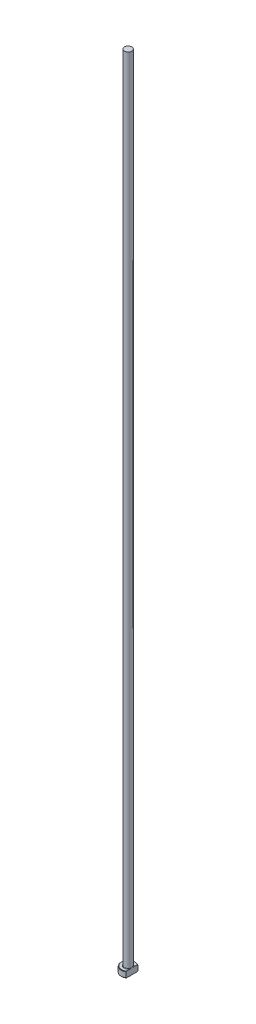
SolidWorks part; units mm, degrees
ref_plane "Front Plane" through (0, 0, 0) normal (0, 0, 1) x (1, 0, 0)
ref_plane "Top Plane" through (0, 0, 0) normal (0, 1, 0) x (1, 0, 0)
ref_plane "Right Plane" through (0, 0, 0) normal (1, 0, 0) x (0, 0, -1)
sketch "Sketch1" plane through (0, 0, 0) normal (0, 0, 1) x (1, 0, 0)
  line L0 (0, 259.9588) -> (0, -15.1925) construction
  line L1 (0, 0) -> (-3.5, 0)
  line L2 (-3.5, 0) -> (-3.5, 3)
  line L3 (-3.5, 3) -> (-1.85, 3)
  line L4 (-1.85, 3) -> (-1.85, 400)
  line L5 (-1.85, 400) -> (0, 400)
  line L6 (0, 400) -> (0, 0)
  dimension "L" = 400
  dimension "H" = 7
  dimension "T" = 3
  dimension "D" = 3.7
revolve "Revolve1" add sketch "Sketch1" angle 360 about L0
chamfer "Chamfer1" distance 0.2 angle 45 2 edges at (0, 3, 3.5) (0, 0, 3.5)
fillet "Fillet1" radius 0.2 1 edges at (0, 3, 1.85)
sketch "Sketch2" plane through (0, 0, 0) normal (0, 1, 0) x (1, 0, 0)
  line L0 (1.85, 2.9711) -> (1.85, -2.9711)
  circle A0 centre (0, 0) radius 3.5 construction
  arc A1 (1.85, -2.9711) -> (1.85, 2.9711) centre (0, 0) ccw
  circle A2 centre (0, 0) radius 1.85 construction
extrude "KEY" cut sketch "Sketch2" along normal through all
